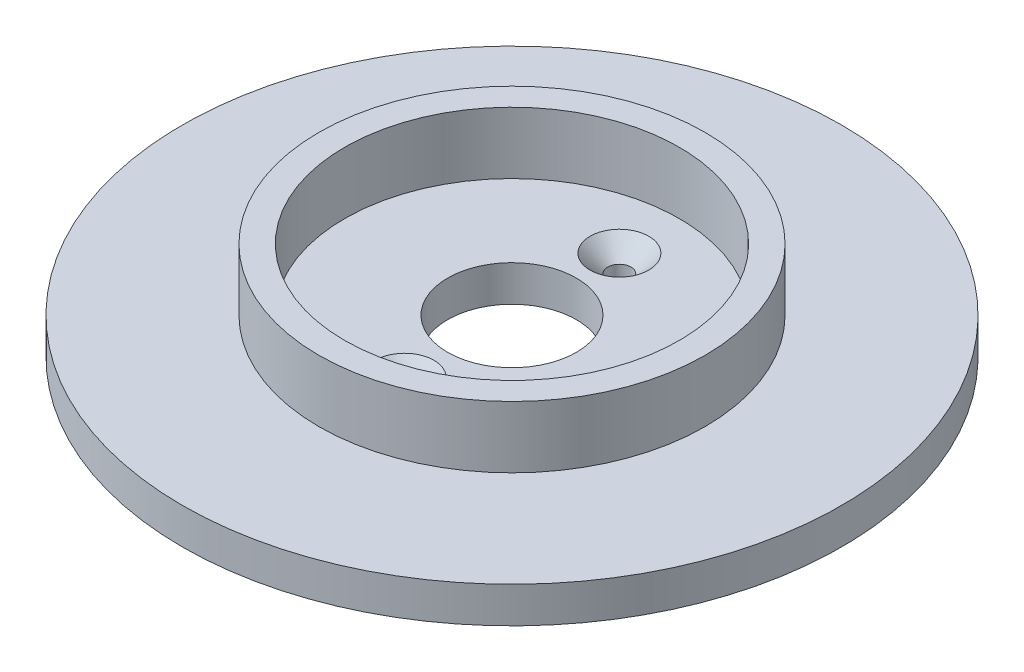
SolidWorks part; units mm, degrees
ref_plane "Front" through (0, 0, 0) normal (0, 0, 1) x (1, 0, 0)
ref_plane "Top" through (0, 0, 0) normal (0, 1, 0) x (1, 0, 0)
ref_plane "Right" through (0, 0, 0) normal (1, 0, 0) x (0, 0, -1)
sketch "Sketch1" plane through (0, 0, 0) normal (0, 1, 0) x (1, 0, 0)
  circle A0 centre (0, 0) radius 64
  dimension "D1" = 128
extrude "Extrude1" add sketch "Sketch1" along normal blind 7
sketch "Sketch2" plane through (0, 7, 0) normal (0, 1, 0) x (1, 0, 0)
  circle A0 centre (0, 0) radius 37.5
  circle A1 centre (0, 0) radius 32.5
  dimension "D1" = 75
  dimension "D2" = 5
extrude "Extrude2" add sketch "Sketch2" along normal blind 12
sketch "Sketch6" plane through (0, 7, 0) normal (0, 1, 0) x (1, 0, 0)
  circle A0 centre (0, 0) radius 12.5
  dimension "D1" = 25
extrude "Extrude6" cut sketch "Sketch6" against normal through all
sketch "Sketch7" plane through (0, 7, 0) normal (0, 1, 0) x (1, 0, 0)
  line L0 (0, 47.357) -> (0, -49.3386) construction
hole_wizard "CSK for M4 Flat Head Machine Screw1" positions "3DSketch1" profile "Sketch8" countersink size "M4" standard "Ansi Metric"
sketch3d "3DSketch1"
  line L0 (0, 7, -47.357) -> (0, 7, 49.3386) construction
  point P0 (0, 7, -20.8567)
  point P4 (0, 7, 20.8567)
  dimension "D1" = 22
  dimension "D2" = 22
sketch "Sketch8" plane through (0, 7, -20.8567) normal (1, 0, 0) x (0, 0, 1)
  line L0 (0, 0) -> (0, 7)
  line L1 (0, 7) -> (2.25, 7)
  line L2 (2.25, 7) -> (2.25, 3.45)
  line L3 (2.25, 3.45) -> (5.7, 0)
  line L5 (5.7, 0) -> (0, 0)
  line L6 (-2.25, 3.45) -> (-5.7, 0) construction
  line L11 (0, -6.35) -> (0, 107.95) construction
  dimension "Thru Hole Dia." = 4.5
  dimension "Thru Hole Depth" = 7
  dimension "Near C'Sink Dia." = 11.4
  dimension "Near C'Sink Angle" = 90
